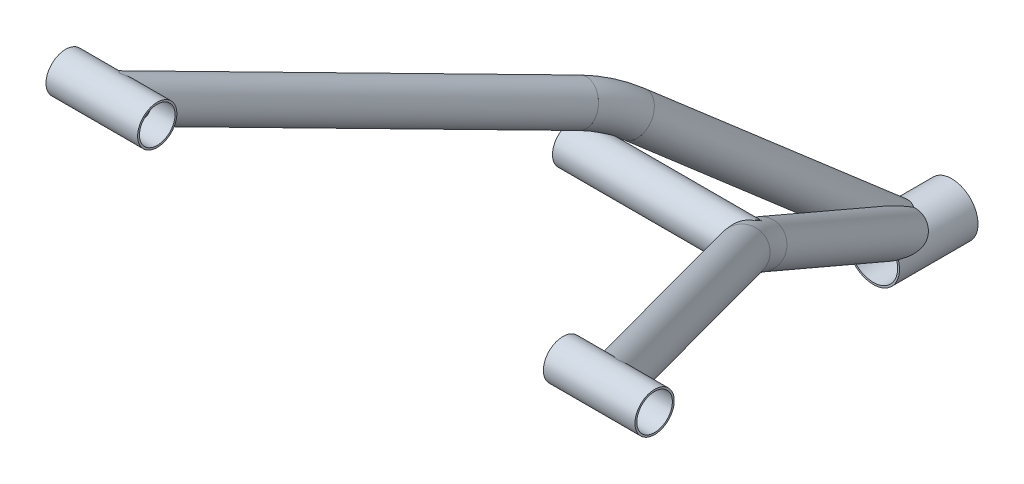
SolidWorks part; units mm, degrees
ref_plane "Front Plane" through (0, 0, 0) normal (0, 0, 1) x (1, 0, 0)
ref_plane "Top Plane" through (0, 0, 0) normal (0, 1, 0) x (1, 0, 0)
ref_plane "Right Plane" through (0, 0, 0) normal (1, 0, 0) x (0, 0, -1)
sketch "Sketch1" plane through (0, 0, 0) normal (0, 1, 0) x (1, 0, 0)
  line L0 (-142.875, 0) -> (142.875, 0) construction
  line L1 (-142.875, 0) -> (-98.425, 0)
  line L2 (142.875, 0) -> (98.425, 0)
  point P3 (120.65, 0)
  point P6 (-120.65, 0)
  dimension "D1" = 285.75
  dimension "D2" = 44.45
  dimension "D3" = 44.45
ref_plane "Plane1" through (0, 0, 0) normal (0, 0.8805, -0.4741) x (1, 0, 0)
sketch "Sketch2" plane through (0, 0, 0) normal (0, 0.8805, -0.4741) x (1, 0, 0)
  line L0 (-53.975, 0) -> (-53.975, 387.35) construction
  line L1 (-142.875, 1.1301) -> (-53.975, 1.1301) construction
  line L2 (-142.875, 0) -> (-142.875, 1.1301) construction
  line L3 (-12.7, 228.6) -> (120.65, 0)
  line L4 (-53.975, 0) -> (-53.975, 228.6) construction
  line L5 (-3.175, 228.6) -> (-98.425, 228.6)
  line L6 (142.875, 0) -> (98.425, 0) construction
  line L7 (-12.7, 228.6) -> (-98.425, 228.6)
  point P2 (-12.7, 228.6)
  dimension "D1" = 387.35
  dimension "D2" = 88.9
  dimension "D3" = 228.6
  dimension "D4" = 50.8
  dimension "D5" = 44.45
  dimension "D6" = 9.525
ref_plane "Plane2" through (0, -183.6381, 0) normal (0, 1, 0) x (1, 0, 0)
sketch "Sketch3" plane through (0, -183.6381, 0) normal (0, 1, 0) x (1, 0, 0)
  line L0 (-53.975, 341.0529) -> (-53.975, 302.9529)
  line L1 (-83.369, 322.0029) -> (-30.7181, 322.0029) construction
  point P3 (-53.975, 322.0029)
  dimension "D1" = 38.1
other "Structural Member1"
ref_plane "Plane3" through (-53.975, -183.6381, -341.0529) normal (0, 0, 1) x (1, 0, 0)
sketch "Sketch11" plane through (-53.975, -183.6381, -341.0529) normal (0, 0, 1) x (1, 0, 0)
  circle A0 centre (0, 0) radius 11.811
  circle A1 centre (0, 0) radius 12.7
  point P5 (0, 0)
  dimension "Out_dia" = 25.4
  dimension "D1" = 0.889
other "Structural Member2"
ref_plane "Plane4" through (142.875, 0, 0) normal (-1, 0, 0) x (0, 0, 1)
sketch "Sketch12" plane through (142.875, 0, 0) normal (-1, 0, 0) x (0, 0, 1)
  circle A0 centre (0, 0) radius 8.636
  circle A1 centre (0, 0) radius 9.525
  point P5 (0, 0)
  dimension "Out_dia" = 19.05
  dimension "D1" = 0.889
other "Structural Member3"
ref_plane "Plane5" through (-3.175, -108.3766, -201.2771) normal (-1, 0, 0) x (0, 0.4741, 0.8805)
sketch "Sketch13" plane through (-3.175, -108.3766, -201.2771) normal (-1, 0, 0) x (0, 0.4741, 0.8805)
  circle A0 centre (0, 0) radius 8.636
  circle A1 centre (0, 0) radius 9.525
  point P5 (0, 0)
  dimension "Out_dia" = 19.05
  dimension "D1" = 0.889
ref_plane "Plane6" through (0, -108.3766, -201.2771) normal (0, -0.4741, -0.8805) x (-1, 0, 0)
sketch "Sketch14" plane through (0, -108.3766, -201.2771) normal (0, -0.4741, -0.8805) x (-1, 0, 0)
  line L0 (53.975, 0) -> (53.975, 19.05) construction
  line L1 (3.175, 0) -> (98.425, 0) construction
  dimension "D1" = 19.05
ref_plane "Plane7" through (0, 0, 0) normal (0, 0.9168, -0.3993) x (1, 0, 0)
ref_plane "Plane8" through (0, 48.654, -40.0902) normal (0, -0.7718, 0.6359) x (-1, 0, 0)
sketch "Sketch15" plane through (0, 0, 0) normal (0, 0.9168, -0.3993) x (1, 0, 0)
  line L0 (-3.175, 227.8104) -> (-98.425, 227.8104) construction
  line L1 (-3.175, 227.8104) -> (-98.425, 227.8104) construction
  line L2 (-120.65, 0) -> (-88.9, 227.8104)
  point P3 (-88.9, 227.8104)
  point P4 (-12.7, 227.8104)
  dimension "D1" = 9.525
  dimension "D2" = 9.525
sketch "Sketch16" plane through (0, 48.654, -40.0902) normal (0, -0.7718, 0.6359) x (-1, 0, 0)
  line L0 (3.175, 219.0383) -> (98.425, 219.0383) construction
  line L1 (3.175, 219.0383) -> (98.425, 219.0383)
  line L3 (53.975, 365.2867) -> (88.9, 219.0383)
  point P0 (12.7, 219.0383)
  point P1 (88.9, 219.0383)
ref_plane "Plane9" through (0, 12.3152, -7.6774) normal (0, -0.8486, 0.529) x (-1, 0, 0)
sketch "Sketch18" plane through (0, 12.3152, -7.6774) normal (0, -0.8486, 0.529) x (-1, 0, 0)
  line L0 (12.7, 228.1389) -> (53.975, 370.4028)
sketch3d "3DSketch1"
  line L0 (120.65, 0, 0) -> (-7.0148, -103.7561, -192.696)
  line L1 (-15.8439, -114.1092, -210.4727) -> (-53.975, -183.6381, -322.0029)
  line L2 (-53.975, -183.6381, -322.0029) -> (-85.8688, -98.7079, -218.9305)
  line L3 (-90.7004, -85.4965, -197.2753) -> (-120.65, 0, 0)
  arc A0 (-7.0148, -103.7561, -192.696) -> (-15.8439, -114.1092, -210.4727) centre (67.453, -143.454, -220.6572) ccw
  arc A1 (-90.7004, -85.4965, -197.2753) -> (-85.8688, -98.7079, -218.9305) centre (-59.727, -160.1365, -160.225) ccw
  point P12 (-12.7, -108.3766, -201.2771)
  point P13 (48.7115, -214.1785, -170.1595)
  point P16 (-88.9, -90.6362, -209.1346)
  point P17 (-142.1492, -193.3957, -158.324)
  dimension "D1" = 88.9
other "Structural Member4"
ref_plane "Plane11" through (-7.0148, -103.7561, -192.696) normal (-0.5039, -0.4095, -0.7605) x (-0.0602, -0.8617, 0.5039)
sketch "Sketch19" plane through (-7.0148, -103.7561, -192.696) normal (-0.5039, -0.4095, -0.7605) x (-0.0602, -0.8617, 0.5039)
  circle A0 centre (0, 0) radius 8.636
  circle A1 centre (0, 0) radius 9.525
  point P5 (0, 0)
  dimension "Out_dia" = 19.05
  dimension "D1" = 0.889
other "Structural Member5"
ref_plane "Plane12" through (-90.7004, -85.4965, -197.2753) normal (0.138, -0.3938, -0.9088) x (0.7914, 0.5956, -0.138)
sketch "Sketch110" plane through (-90.7004, -85.4965, -197.2753) normal (0.138, -0.3938, -0.9088) x (0.7914, 0.5956, -0.138)
  circle A0 centre (0, 0) radius 8.636
  circle A1 centre (0, 0) radius 9.525
  point P5 (0, 0)
  dimension "Out_dia" = 19.05
  dimension "D1" = 0.889
other "Structural Member6"
ref_plane "Plane13" through (-90.7004, -85.4965, -197.2753) normal (-0.138, 0.3938, 0.9088) x (-0.9873, -0.1272, -0.0948)
sketch "Sketch111" plane through (-90.7004, -85.4965, -197.2753) normal (-0.138, 0.3938, 0.9088) x (-0.9873, -0.1272, -0.0948)
  circle A0 centre (0, 0) radius 8.636
  circle A1 centre (0, 0) radius 9.525
  point P5 (0, 0)
  dimension "Out_dia" = 19.05
  dimension "D1" = 0.889
delete or keep bodies "Body-Delete/Keep 1" type delete bodies bodies 104
other "Structural Member7"
ref_plane "Plane14" through (-12.7, -108.3766, -201.2771) normal (-1, 0, 0) x (0, 0.4741, 0.8805)
sketch "Sketch112" plane through (-12.7, -108.3766, -201.2771) normal (-1, 0, 0) x (0, 0.4741, 0.8805)
  circle A0 centre (0, 0) radius 8.636
  circle A1 centre (0, 0) radius 9.525
  point P5 (0, 0)
  dimension "Out_dia" = 19.05
  dimension "D1" = 0.889
sketch "Sketch113" plane through (0, 0, -341.0529) normal (0, 0, -1) x (-1, 0, 0)
  circle A0 centre (53.975, -183.6381) radius 11.811 construction
  circle A1 centre (53.975, -183.6381) radius 11.811
extrude "Cut-Extrude1" cut sketch "Sketch113" against normal through all
sketch "Sketch114" plane through (0, 0, -341.0529) normal (0, 0, -1) x (-1, 0, 0)
  circle A0 centre (53.975, -183.6381) radius 44.5906
extrude "Cut-Extrude2" cut sketch "Sketch114" along normal blind 25.4 contours A0
sketch "Sketch115" plane through (0, 0, -341.0529) normal (0, 0, -1) x (-1, 0, 0)
  line L0 (51.3821, -196.0706) -> (57.15, -206.4874)
  line L1 (57.15, -206.4874) -> (62.2632, -205.5131)
  line L2 (62.2632, -205.5131) -> (61.6897, -193.7263)
  arc A0 (61.6897, -193.7263) -> (51.3821, -196.0706) centre (53.975, -183.6381) cw
  circle A1 centre (53.975, -183.6381) radius 12.7 construction
extrude "Cut-Extrude3" cut sketch "Sketch115" against normal blind 25.4
sketch "Sketch116" plane through (142.875, 0, 0) normal (1, 0, 0) x (0, 0, -1)
  circle A0 centre (0, 0) radius 8.636 construction
  circle A1 centre (0, 0) radius 8.636
extrude "Cut-Extrude4" cut sketch "Sketch116" against normal through all
sketch "Sketch117" plane through (0, 0, -341.0529) normal (0, 0, -1) x (-1, 0, 0)
  circle A0 centre (53.975, -183.6381) radius 11.811 construction
  circle A1 centre (53.975, -183.6381) radius 11.811
extrude "Cut-Extrude5" cut sketch "Sketch117" against normal through all
sketch "Sketch118" plane through (0, 0, -341.0529) normal (0, 0, -1) x (-1, 0, 0)
  circle A0 centre (53.975, -183.6381) radius 12.7 construction
  circle A1 centre (53.975, -183.6381) radius 12.7
extrude "Cut-Extrude6" cut sketch "Sketch118" along normal blind 25.4
sketch "Sketch119" plane through (0, 0, -341.0529) normal (0, 0, -1) x (-1, 0, 0)
  line L0 (53.4058, -196.3253) -> (52.077, -206.4689)
  line L1 (52.077, -206.4689) -> (60.7412, -206.9412)
  line L2 (60.7412, -206.9412) -> (65.1105, -199.3745)
  line L3 (65.1105, -199.3745) -> (62.2809, -193.2455)
  arc A0 (62.2809, -193.2455) -> (53.4058, -196.3253) centre (53.975, -183.6381) cw
  circle A1 centre (53.975, -183.6381) radius 12.7 construction
extrude "Cut-Extrude7" cut sketch "Sketch119" against normal through all both and the other way through all
sketch "Sketch120" plane through (0, 0, -341.0529) normal (0, 0, -1) x (-1, 0, 0)
  line L0 (46.0391, -193.5533) -> (42.5401, -202.8566)
  line L1 (42.5401, -202.8566) -> (54.7494, -210.7877)
  line L2 (54.7494, -210.7877) -> (62.1957, -206.0769)
  line L3 (62.1957, -206.0769) -> (60.86, -201.381)
  line L4 (60.86, -201.381) -> (57.521, -195.833)
  arc A0 (46.0391, -193.5533) -> (57.521, -195.833) centre (53.975, -183.6381) ccw
  circle A2 centre (53.975, -183.6381) radius 12.7 construction
extrude "Cut-Extrude9" cut sketch "Sketch120" against normal blind 25.4 contours L1 L2 L3 L4 A0 L0
sketch3d "3DSketch2"
  line L0 (-53.975, -183.6381, -341.0529) -> (-53.975, -183.6381, -366.4529)
  line L1 (-53.975, -183.6381, -341.0529) -> (-53.975, -183.6381, -302.9529) construction
  dimension "D1" = 25.4
